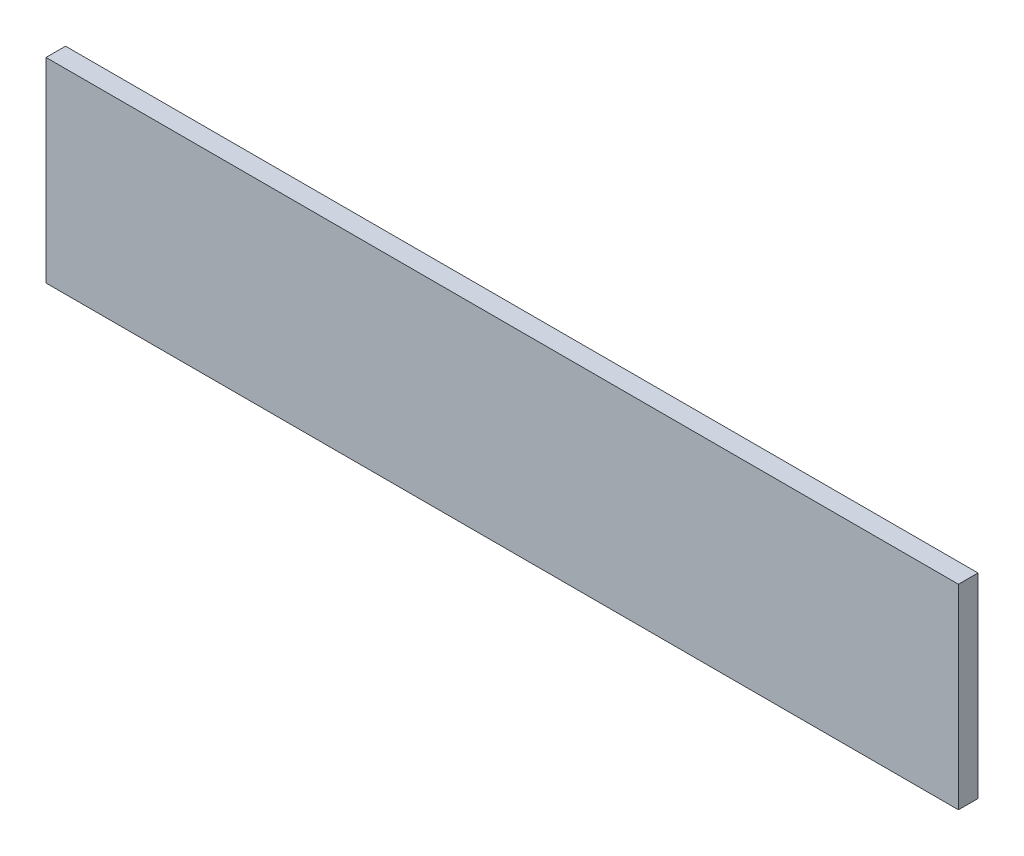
SolidWorks part; units mm, degrees
ref_plane "Front Plane" through (0, 0, 0) normal (0, 0, 1) x (1, 0, 0)
ref_plane "Top Plane" through (0, 0, 0) normal (0, 1, 0) x (1, 0, 0)
ref_plane "Right Plane" through (0, 0, 0) normal (1, 0, 0) x (0, 0, -1)
sketch "Sketch2" plane through (0, 0, 0) normal (0, 0, 1) x (1, 0, 0)
  line L1 (-233.5, 50) -> (233.5, 50)
  line L2 (-233.5, 50) -> (-233.5, -50)
  line L3 (-233.5, -50) -> (233.5, -50)
  line L4 (233.5, 50) -> (233.5, -50)
  line L5 (-233.5, 50) -> (233.5, -50) construction
  line L6 (-233.5, -50) -> (233.5, 50) construction
  point P0 (0, 0)
  dimension "D1" = 100
  dimension "D2" = 467
extrude "Boss-Extrude1" add sketch "Sketch2" along normal blind 10
